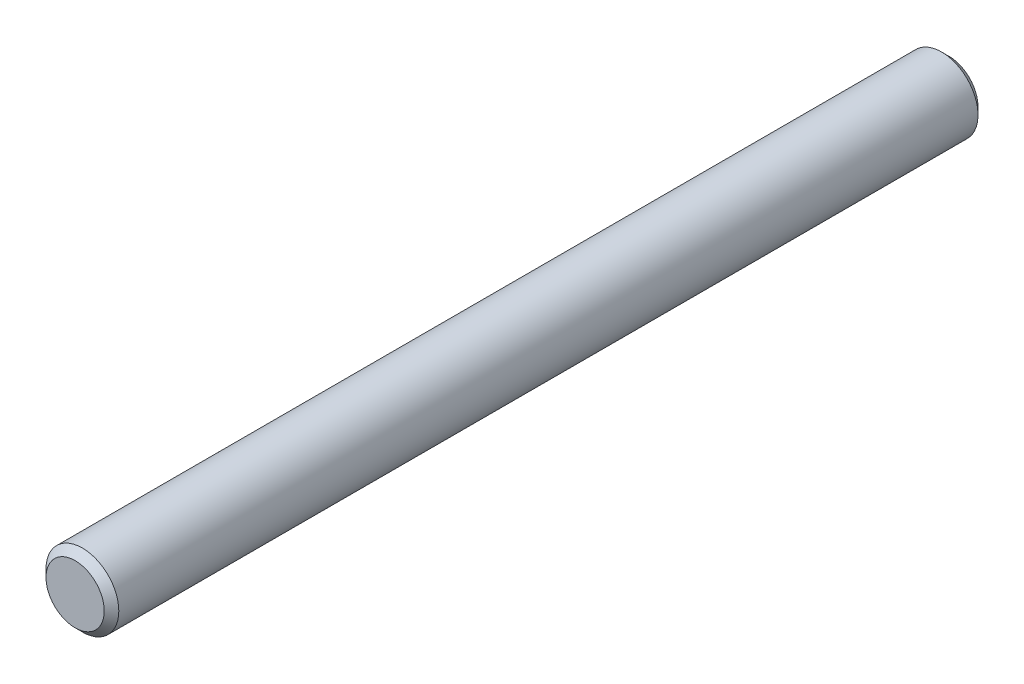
SolidWorks part; units mm, degrees
ref_plane "XY" through (0, 0, 0) normal (0, 0, 1) x (1, 0, 0)
ref_plane "XZ" through (0, 0, 0) normal (0, 1, 0) x (1, 0, 0)
ref_plane "YZ" through (0, 0, 0) normal (1, 0, 0) x (0, 0, -1)
sketch "Esquisse1" plane through (0, 0, 0) normal (0, 1, 0) x (1, 0, 0)
  line L0 (0, 83.092) -> (0, -3.2136) construction
  line L1 (0, 67.041) -> (0, -3.2136) construction
  line L2 (0, 120) -> (-5, 120)
  line L3 (0, 120) -> (0, 0)
  line L4 (0, 0) -> (-5, 0)
  line L5 (-5, 120) -> (-5, 0)
  dimension "D1" = 10
  dimension "D2" = 120
revolve "Tige" add sketch "Esquisse1" angle 360 about L0
chamfer "Chanf1" distance 1 angle 45
